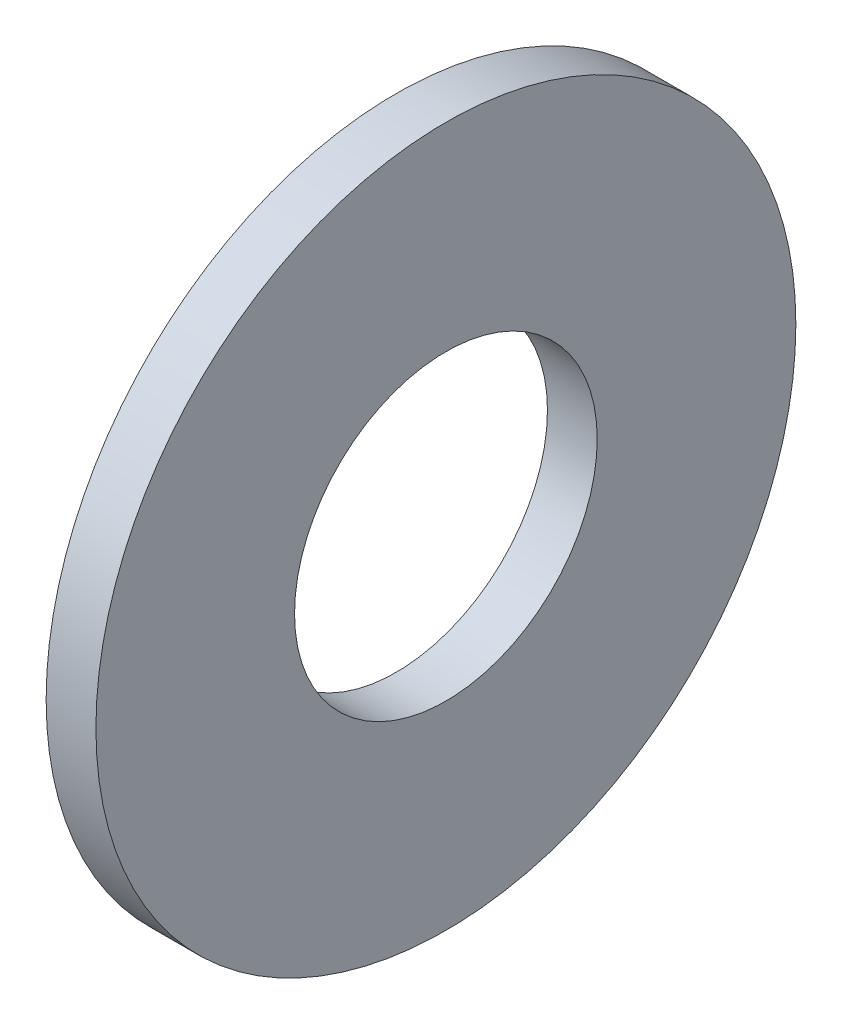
SolidWorks part; units mm, degrees
ref_plane "Plane1" through (0, 0, 0) normal (0, 0, 1) x (1, 0, 0)
ref_plane "Plane2" through (0, 0, 0) normal (0, 1, 0) x (1, 0, 0)
ref_plane "Plane3" through (0, 0, 0) normal (1, 0, 0) x (0, 0, -1)
other "Configuration Table"
sketch "Sketch1" plane through (0, 0, 0) normal (0, 0, 1) x (1, 0, 0)
  line L0 (-34.925, 0) -> (9.525, 0) construction
  line L1 (0, 19.46) -> (0, 45)
  line L2 (0, 45) -> (-6.4, 45)
  line L3 (-6.4, 45) -> (-6.4, 19.46)
  line L4 (-6.4, 19.46) -> (0, 19.46)
  dimension "Thickness" = 6.4
  dimension "Inside_dia" = 38.92
  dimension "Outside_dia" = 90
revolve "Base-Revolve" add sketch "Sketch1" angle 360 about L0
